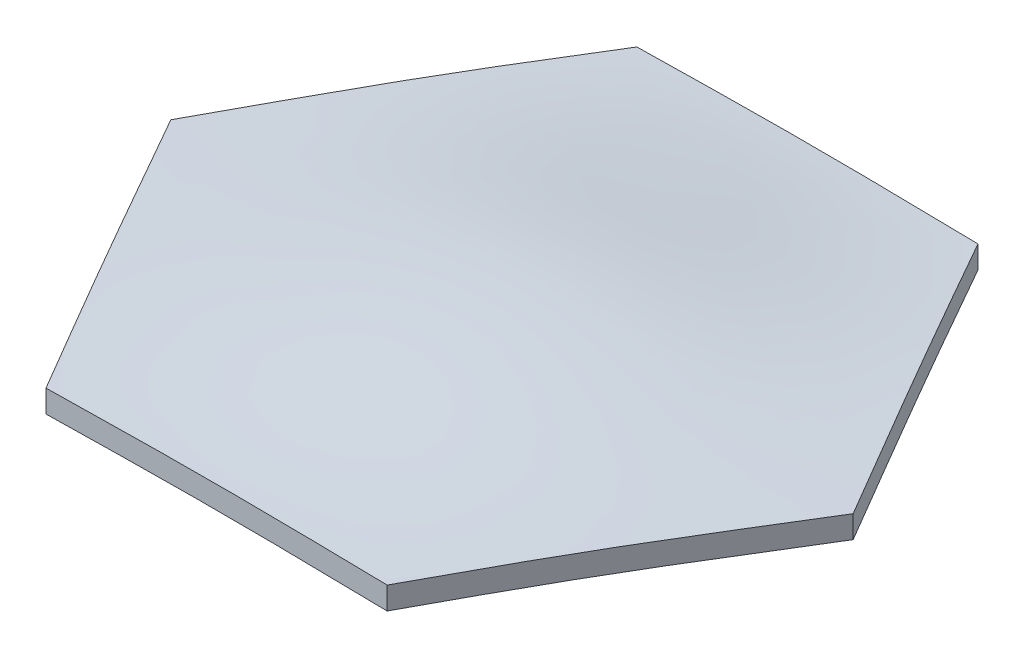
SolidWorks part; units mm, degrees
ref_plane "Front Plane" through (0, 0, 0) normal (0, 0, 1) x (1, 0, 0)
ref_plane "Top Plane" through (0, 0, 0) normal (0, 1, 0) x (1, 0, 0)
ref_plane "Right Plane" through (0, 0, 0) normal (1, 0, 0) x (0, 0, -1)
sketch "Sketch1" plane through (0, 0, 0) normal (0, 1, 0) x (1, 0, 0)
  line L0 (54.3639, -50.5343) -> (-54.3639, 50.5343) construction
  line L1 (-54.3639, 50.5343) -> (54.3639, 50.5343) construction
  line L2 (-54.3639, 50.5343) -> (-54.3639, -50.5343) construction
  line L3 (-54.3639, -50.5343) -> (54.3639, -50.5343) construction
  line L4 (54.3639, 50.5343) -> (54.3639, -50.5343) construction
  line L6 (54.8483, 0) -> (27.4241, 47.5)
  line L7 (27.4241, 47.5) -> (-27.4241, 47.5)
  line L8 (-27.4241, 47.5) -> (-54.8483, 0)
  line L9 (-54.8483, 0) -> (-27.4241, -47.5)
  line L10 (-27.4241, -47.5) -> (27.4241, -47.5)
  line L11 (27.4241, -47.5) -> (54.8483, 0)
  circle A0 centre (0, 0) radius 47.5 construction
  dimension "D1" = 95
extrude "Extrude1" add sketch "Sketch1" along normal blind 3.6188
other "Deform2" parameters "D1"=50, "D2"=100
